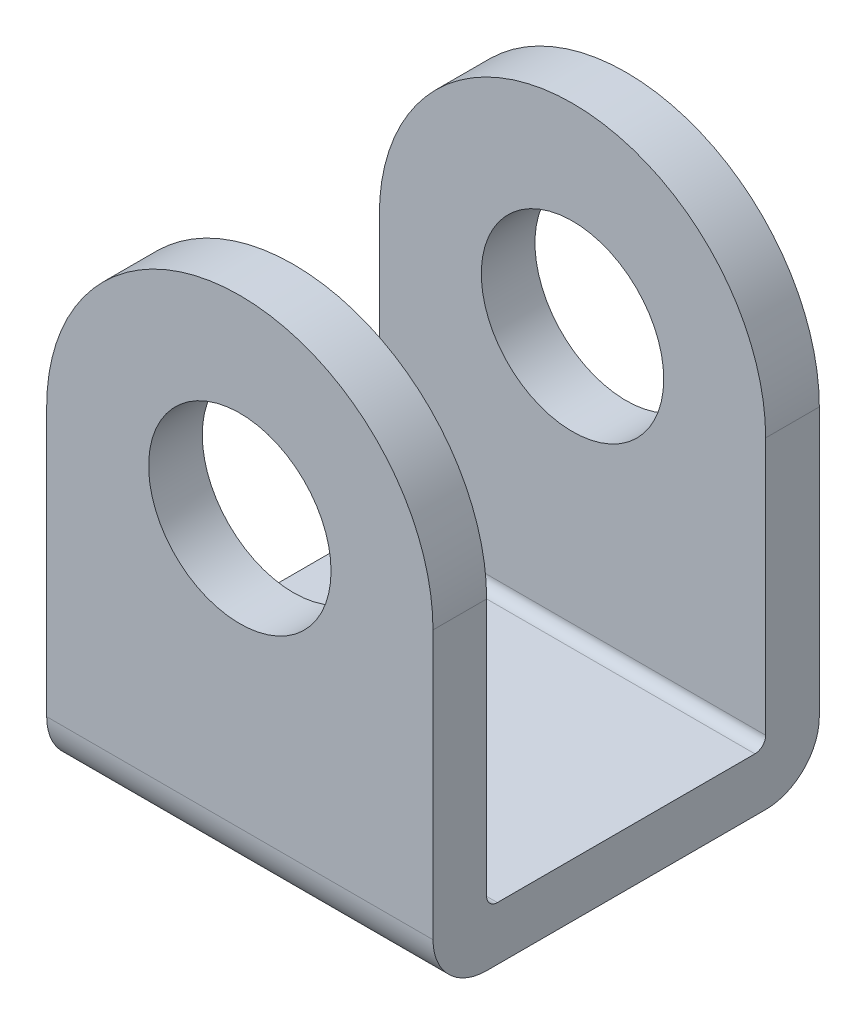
SolidWorks part; units mm, degrees
ref_plane "Plan de face" through (0, 0, 0) normal (0, 0, 1) x (1, 0, 0)
ref_plane "Plan de dessus" through (0, 0, 0) normal (0, 1, 0) x (1, 0, 0)
ref_plane "Plan de droite" through (0, 0, 0) normal (1, 0, 0) x (0, 0, -1)
sketch "Esquisse1" plane through (0, 0, 0) normal (0, 0, 1) x (1, 0, 0)
  line L3 (-9, 0) -> (9, 0)
  line L4 (-9, 0) -> (-9, 2.5)
  line L5 (-9, 2.5) -> (9, 2.5)
  line L6 (9, 0) -> (9, 2.5)
  point P10 (0, 0)
  dimension "D2" = 18
  dimension "D4" = 2.5
extrude "Boss.-Extru.1" add sketch "Esquisse1" along normal mid plane 18
sketch "Esquisse2" plane through (0, 0, 9) normal (0, 0, 1) x (1, 0, 0)
  line L0 (-9, 2.5) -> (-9, 15)
  line L1 (9, 15) -> (9, 2.5)
  line L2 (-9, 2.5) -> (9, 2.5)
  line L3 (9, 2.5) -> (-9, 2.5) construction
  line L4 (-9, 2.5) -> (-9, 0) construction
  line L5 (9, 0) -> (9, 2.5) construction
  line L6 (-9, 0) -> (9, 0) construction
  arc A2 (-9, 15) -> (9, 15) centre (0, 15) cw
  dimension "D1" = 15
extrude "Boss.-Extru.2" add sketch "Esquisse2" against normal blind 2.5
mirror "Symétrie1" about plane through (0, 0, 0) normal (0, 0, 1) of "Boss.-Extru.2", "Boss.-Extru.1"
sketch "Esquisse3" plane through (0, 0, 9) normal (0, 0, 1) x (1, 0, 0)
  circle A0 centre (0, 15) radius 4.25
  arc A1 (9, 15) -> (-9, 15) centre (0, 15) ccw construction
  dimension "D1" = 8.5
extrude "Enlèv. mat.-Extru.1" cut sketch "Esquisse3" against normal through all
fillet "Congé1" radius 0.5 2 edges at (0, 2.5, -6.5)
fillet "Congé2" radius 2.5 2 edges at (0, 0, -9) (0, 0, 9)
